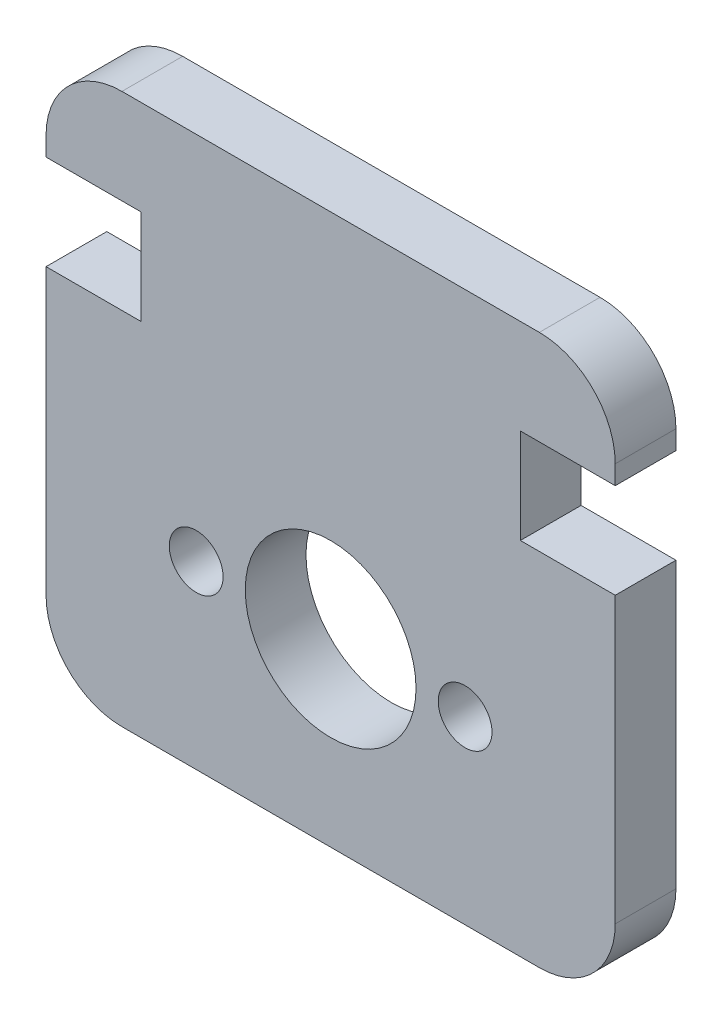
SolidWorks part; units mm, degrees
ref_plane "Front Plane" through (0, 0, 0) normal (0, 0, 1) x (1, 0, 0)
ref_plane "Top Plane" through (0, 0, 0) normal (0, 1, 0) x (1, 0, 0)
ref_plane "Right Plane" through (0, 0, 0) normal (1, 0, 0) x (0, 0, -1)
sketch "Sketch1" plane through (0, 0, 0) normal (0, 0, 1) x (1, 0, 0)
  line L1 (-9.525, 7.62) -> (9.525, 7.62)
  line L2 (-9.525, 7.62) -> (-9.525, -7.62)
  line L3 (-9.525, -7.62) -> (9.525, -7.62)
  line L4 (9.525, 7.62) -> (9.525, -7.62)
  line L5 (-9.525, 7.62) -> (9.525, -7.62) construction
  line L6 (-9.525, -7.62) -> (9.525, 7.62) construction
  point P0 (0, 0)
  dimension "D1" = 15.24
  dimension "D2" = 19.05
extrude "Boss-Extrude1" add sketch "Sketch1" along normal mid plane 2.032
sketch "Sketch2" plane through (0, 0, 1.016) normal (0, 0, 1) x (1, 0, 0)
  line L0 (0, 8.1476) -> (0, -8.6207) construction
  line L1 (-9.525, 4.445) -> (9.525, 4.445) construction
  line L2 (-9.525, 7.62) -> (-9.525, -7.62) construction
  line L3 (9.525, -7.62) -> (9.525, 7.62) construction
  line L5 (9.525, 7.62) -> (-9.525, 7.62) construction
  circle A0 centre (0, -1.5875) radius 2.8575
  dimension "D1" = 5.715
  dimension "D2" = 3.175
  dimension "D3" = 6.0325
extrude "Cut-Extrude1" cut sketch "Sketch2" against normal through all
sketch "Sketch3" plane through (0, 0, 1.016) normal (0, 0, 1) x (1, 0, 0)
  line L0 (0, 8.0908) -> (0, -8.81) construction
  line L1 (-9.525, 7.62) -> (-6.35, 7.62)
  line L2 (-9.525, 7.62) -> (-9.525, 4.445)
  line L3 (-9.525, 4.445) -> (-6.35, 4.445)
  line L4 (-6.35, 7.62) -> (-6.35, 4.445)
  line L5 (6.35, 7.62) -> (6.35, 4.445)
  line L6 (9.525, 4.445) -> (6.35, 4.445)
  line L7 (9.525, 7.62) -> (9.525, 4.445)
  line L8 (9.525, 7.62) -> (6.35, 7.62)
  dimension "D1" = 3.175
  dimension "D2" = 3.175
extrude "Cut-Extrude2" cut sketch "Sketch3" against normal through all
hole_wizard "M1.6 Clearance Hole1" positions "Sketch5" profile "Sketch4" hole size "M1.6" standard "Ansi Metric"
sketch "Sketch5" plane through (0, 0, 1.016) normal (0, 0, 1) x (1, 0, 0)
  line L0 (-9.525, 4.445) -> (-6.35, 4.445) construction
  circle A3 centre (0, -1.5875) radius 2.8575 construction
  point P0 (-4.5, -1.5875)
  point P1 (4.5, -1.5875)
  dimension "D1" = 6.0325
  dimension "D2" = 9
  dimension "D3" = 4.5
sketch "Sketch4" plane through (-4.5, -1.5875, 1.016) normal (1, 0, 0) x (0, -1, 0)
  line L0 (0, 0) -> (0, 2.5728)
  line L1 (0, 2.5728) -> (0.9, 2.032)
  line L2 (0.9, 2.032) -> (0.9, 0)
  line L5 (0.9, 0) -> (0, 0)
  line L10 (0, 2.5728) -> (-0.9, 2.032) construction
  line L11 (0, -6.35) -> (0, 107.95) construction
  dimension "Hole Dia." = 1.8
  dimension "Hole Depth" = 2.032
  dimension "Drill Angle" = 118
fillet "Fillet1" radius 2.54 2 edges at (9.525, -7.62, 0) (-9.525, -7.62, 0)
sketch "Sketch6" plane through (0, 0, 1.016) normal (0, 0, 1) x (1, 0, 0)
  line L0 (6.35, 7.62) -> (-6.35, 7.62) construction
  line L1 (-9.525, 7.62) -> (9.525, 7.62)
  line L2 (-9.525, 7.62) -> (-9.525, 10.795)
  line L3 (-9.525, 10.795) -> (9.525, 10.795)
  line L4 (9.525, 7.62) -> (9.525, 10.795)
  line L5 (-9.525, 4.445) -> (-9.525, -5.08) construction
  dimension "D1" = 3.175
  dimension "D2" = 19.05
extrude "Boss-Extrude2" add sketch "Sketch6" against normal blind 2.032
fillet "Fillet2" radius 2.54 2 edges at (-9.525, 10.795, 0) (9.525, 10.795, 0)
